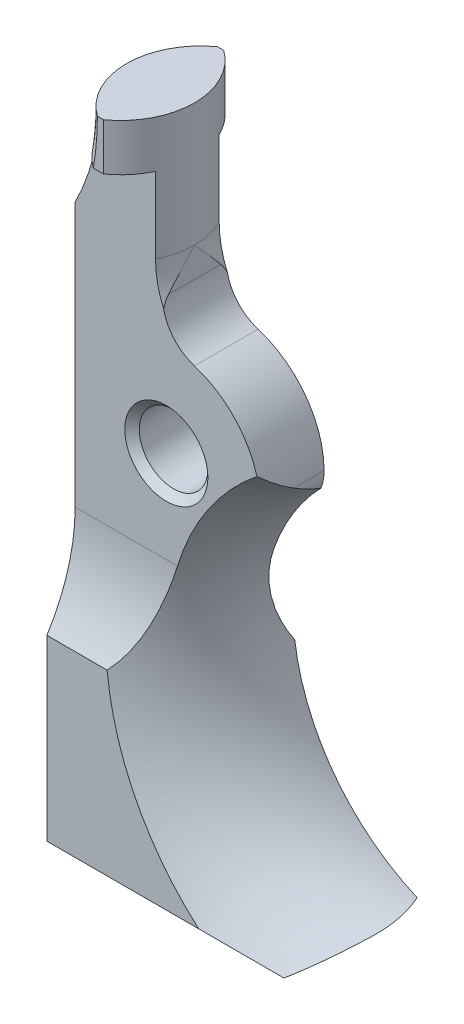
SolidWorks part; units mm, degrees
ref_plane "Спереди" through (0, 0, 0) normal (0, 0, 1) x (1, 0, 0)
ref_plane "Сверху" through (0, 0, 0) normal (0, 1, 0) x (1, 0, 0)
ref_plane "Справа" through (0, 0, 0) normal (1, 0, 0) x (0, 0, -1)
sketch "Эскиз1" plane through (0, 0, 0) normal (0, 0, 1) x (1, 0, 0)
  line L0 (-3.2004, 6.641) -> (-3.2004, -13.7623)
  line L1 (-2.5146, 10.033) -> (-0.127, 10.033)
  line L2 (-9.6993, -15.6972) -> (12.5863, -15.6972) construction
  line L3 (-0.127, 10.033) -> (-0.127, 4.6663)
  line L4 (-9.271, -2.8448) -> (-9.271, 3.9931) construction
  line L5 (10.1854, -2.8448) -> (10.1854, 3.9931) construction
  line L6 (-2.5146, 10.033) -> (-2.5146, 6.7919) construction
  circle A0 centre (0, 0) radius 1.204
  arc A1 (-3.2004, -13.7623) -> (-0.9353, -14.8774) centre (3.5814, -2.8448) ccw
  arc A2 (1.8497, -14.8774) -> (5.8717, -12.4508) centre (-2.667, -2.8448) ccw
  arc A3 (-9.271, -2.8448) -> (3.5814, -15.6972) centre (3.5814, -2.8448) ccw construction
  arc A4 (-2.667, -15.6972) -> (10.1854, -2.8448) centre (-2.667, -2.8448) ccw construction
  arc A5 (5.8717, -12.4508) -> (2.9274, -1.0191) centre (8.4582, -5.6896) cw
  arc A6 (3.302, 0.0098) -> (0.9863, 3.1513) centre (0, 0) ccw
  arc A7 (0.9863, 3.1513) -> (-0.127, 4.6663) centre (1.4605, 4.6663) cw
  arc A8 (2.9274, -1.0191) -> (3.302, 0.0098) centre (1.7145, 0.0051) ccw
  arc A9 (-0.9353, -14.8774) -> (1.8497, -14.8774) centre (0.4572, -11.1677) ccw
  arc A10 (-3.2004, 6.641) -> (-2.5146, 10.033) centre (-11.2459, 10.033) ccw
  point P24 (1.2192, -5.6896)
  point P31 (0.4572, -15.3117)
  dimension "D1" = 2.4079
  dimension "D3" = 12.8524
  dimension "D4" = 12.8524
  dimension "D10" = 7.239
  dimension "D12" = 3.302
  dimension "D13" = 1.5875
  dimension "D14" = 1.5875
  dimension "D15" = 3.9624
  dimension "D16" = 8.7312
  dimension "D2" = 15.6972
  dimension "D5" = 10.3124
  dimension "D6" = 0.127
  dimension "D7" = 9.144
  dimension "D8" = 3.2004
  dimension "D9" = 1.2192
  dimension "D11" = 5.6896
  dimension "D18" = 2.3876
  dimension "D19" = 10.033
extrude "Бобышка-Вытянуть1" add sketch "Эскиз1" along normal mid plane 4.2164
sketch "Эскиз2" plane through (-3.2004, 0, 0) normal (-1, 0, 0) x (0, 0, 1)
  line L0 (0, -7.7795) -> (0, 12.261) construction
  line L1 (1.1176, 8.382) -> (2.1082, 8.382)
  line L2 (1.1176, 8.382) -> (1.1176, -3.23)
  line L3 (2.1082, 6.641) -> (2.1082, -13.7623) construction
  line L4 (2.1082, -6.6357) -> (2.1082, 8.382)
  line L6 (2.1082, 10.033) -> (-2.1082, 10.033) construction
  line L7 (-2.1082, -6.6357) -> (-2.1082, 8.382)
  line L8 (-1.1176, 8.382) -> (-1.1176, -3.23)
  line L9 (-1.1176, 8.382) -> (-2.1082, 8.382)
  arc A0 (2.1082, -6.6357) -> (1.1176, -3.23) centre (7.4676, -3.23) cw
  arc A1 (-2.1082, -6.6357) -> (-1.1176, -3.23) centre (-7.4676, -3.23) ccw
  dimension "D2" = 6.35
  dimension "D1" = 8.382
  dimension "D3" = 2.2352
  dimension "D4" = 16.6687
extrude "Вырез-Вытянуть1" cut sketch "Эскиз2" against normal through all
sketch "Эскиз4" plane through (0, 0, 0) normal (0, 0, 1) x (1, 0, 0)
  arc A0 (-4.263, 4.7914) -> (-2.5146, 10.033) centre (-11.2459, 10.033) ccw
  arc A1 (-3.2004, 6.641) -> (-2.6721, 8.382) centre (-11.2459, 10.033) ccw construction
sketch "Эскиз5" plane through (0, 10.033, 0) normal (0, 1, 0) x (1, 0, 0)
  line L0 (-2.5146, 0) -> (0.2271, 0) construction
  line L3 (-0.127, 2.1082) -> (-2.5146, 2.1082) construction
  line L4 (-0.127, -2.1082) -> (-2.5146, -2.1082) construction
  line L5 (-1.4297, 2.1082) -> (-2.8234, 2.1082)
  line L6 (-2.8234, 2.1082) -> (-2.8234, -2.1082)
  line L7 (-2.8234, -2.1082) -> (-1.4297, -2.1082)
  arc A0 (-1.4297, -2.1082) -> (-1.4297, 2.1082) centre (0.0762, 0) cw
  dimension "D1" = 2.5908
sweep "Вырез-По траектории1" cut profiles "Эскиз5" path "Эскиз4"
sketch "Эскиз6" plane through (0, 0, 0) normal (0, 0, 1) x (1, 0, 0)
  line L0 (-0.127, 10.033) -> (-0.127, 5.715)
  arc A0 (-0.127, 5.715) -> (0.4076, 3.9518) centre (3.048, 5.715) ccw
  arc A1 (3.302, 0.0098) -> (0.9863, 3.1513) centre (0, 0) ccw construction
  dimension "D1" = 3.175
sketch "Эскиз7" plane through (0, 10.033, 0) normal (0, 1, 0) x (1, 0, 0)
  line L0 (-0.127, 0) -> (2.7036, 0) construction
  line L1 (-0.127, 2.1082) -> (-1.4297, 2.1082) construction
  line L2 (-0.127, -2.1082) -> (-1.4297, -2.1082) construction
  line L3 (-1.2119, 2.1082) -> (0.7254, 2.1082)
  line L4 (0.7254, 2.1082) -> (0.7254, -2.1082)
  line L5 (0.7254, -2.1082) -> (-1.2119, -2.1082)
  arc A0 (-1.2119, 2.1082) -> (-1.2119, -2.1082) centre (-2.7178, 0) cw
  dimension "D1" = 2.5908
sweep "Вырез-По траектории2" cut profiles "Эскиз7" path "Эскиз6"
sketch "Эскиз8" plane through (0, 0, 0) normal (1, 0, 0) x (0, 0, -1)
  line L0 (-2.1082, -12.8935) -> (-2.1082, -15.1301)
  line L1 (-2.1082, -15.1301) -> (0.4572, -15.1301)
  line L2 (-2.1082, -15.1301) -> (2.1082, -15.1301) construction
  line L4 (2.1082, -6.6357) -> (2.1082, -13.7623) construction
  line L7 (-2.1082, -6.6357) -> (-2.1082, -13.7623) construction
  line L8 (-0.1041, -14.8977) -> (-2.1082, -12.8935)
  arc A0 (0.4572, -15.1301) -> (-0.1041, -14.8977) centre (0.4572, -14.3364) cw
  dimension "D1" = 1.651
  dimension "D3" = 0.7937
  dimension "D4" = 45
extrude "Вырез-Вытянуть2" cut sketch "Эскиз8" against normal mid plane 11.8364 contours L1 A0 L8 L0
sketch "Эскиз9" plane through (0, 0, -2.1082) normal (0, 0, -1) x (-1, 0, 0)
  arc A0 (-1.8497, -14.8774) -> (0.9353, -14.8774) centre (-0.4572, -11.1677) ccw
  arc A1 (-1.8497, -14.8774) -> (0.9353, -14.8774) centre (-0.4572, -11.1677) ccw construction
  arc A2 (-1.8497, -14.8774) -> (-6.3762, -11.9775) centre (2.667, -2.8448) cw
  arc A3 (0.9353, -14.8774) -> (3.2004, -13.7623) centre (-3.5814, -2.8448) ccw
  arc A4 (-5.8717, -12.4508) -> (-1.8497, -14.8774) centre (2.667, -2.8448) ccw construction
  arc A5 (0.9353, -14.8774) -> (3.2004, -13.7623) centre (-3.5814, -2.8448) ccw construction
sketch "Эскиз10" plane through (-3.2004, 0, 0) normal (-1, 0, 0) x (0, 0, 1)
  line L0 (-2.1082, -13.4234) -> (-2.1082, -13.7623)
  line L1 (-2.1082, -6.6357) -> (-2.1082, -13.7623) construction
  line L2 (-2.1082, -13.7623) -> (-0.4572, -13.7623)
  line L3 (1.2395, -13.7623) -> (-2.1082, -13.7623) construction
  arc A0 (-0.4572, -13.7623) -> (-2.1082, -13.4234) centre (-0.4572, -9.5713) cw
  dimension "D1" = 4.191
  dimension "D2" = 1.651
sweep "Вырез-По траектории3" cut profiles "Эскиз10" path "Эскиз9"
sketch "Эскиз11" plane through (0, 0, 2.1082) normal (0, 0, 1) x (1, 0, 0)
  arc A0 (8.4582, -12.9286) -> (6.0173, 1.1255) centre (8.4582, -5.6896) cw
  arc A1 (1.2813, -6.6357) -> (5.8717, -12.4508) centre (8.4582, -5.6896) ccw construction
ref_plane "Плоскость1" through (6.0173, 1.1255, 2.1082) normal (0.9414, 0.3372, 0) x (0, 0, -1)
sketch "Эскиз12" plane through (6.0173, 1.1255, 2.1082) normal (0.9414, 0.3372, 0) x (0, 0, -1)
  line L0 (0, 0) -> (0, 2.3541)
  line L2 (4.2164, 0) -> (0, 0)
  line L4 (4.2164, -12.5182) -> (4.2164, -5.7098) construction
  arc A0 (4.2164, 0) -> (0, 2.3541) centre (4.2164, 4.953) cw
  dimension "D1" = 4.953
sweep "Вырез-По траектории4" cut profiles "Эскиз12" path "Эскиз11"
chamfer "Фаска1" distance 0.254 angle 45 2 edges at (0, -1.204, -1.1176) (0, 1.204, 1.1176)
